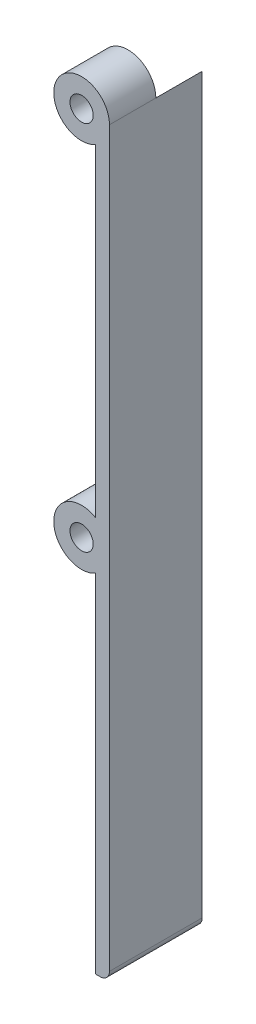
SolidWorks part; units mm, degrees
ref_plane "Plan de face" through (0, 0, 0) normal (0, 0, 1) x (1, 0, 0)
ref_plane "Plan de dessus" through (0, 0, 0) normal (0, 1, 0) x (1, 0, 0)
ref_plane "Plan de droite" through (0, 0, 0) normal (1, 0, 0) x (0, 0, -1)
sketch "Esquisse1" plane through (0, 0, 0) normal (0, 0, 1) x (1, 0, 0)
  line L0 (6, 80) -> (6, -80)
  line L1 (3, 74.8038) -> (3, 5.1962)
  line L2 (3, -5.1962) -> (3, -80)
  line L3 (3, -80) -> (6, -80)
  circle A0 centre (0, 0) radius 2.5
  circle A1 centre (0, 80) radius 2.5
  arc A2 (6, 80) -> (3, 74.8038) centre (0, 80) ccw
  arc A3 (3, 5.1962) -> (3, -5.1962) centre (0, 0) ccw
extrude "Boss.-Extru.1" add sketch "Esquisse1" along normal blind 20
sketch "Esquisse2" plane through (0, 0, 0) normal (0, 0, -1) x (-1, 0, 0)
  circle A2 centre (0, 80) radius 6
  dimension "D1" = 12
extrude "Enlèv. mat.-Extru.1" cut sketch "Esquisse2" against normal blind 10
fillet "Congé1" radius 2 1 edges at (6, -80, 10)
equation "\"D3@Esquisse1\"=\"D2@Esquisse1\""
